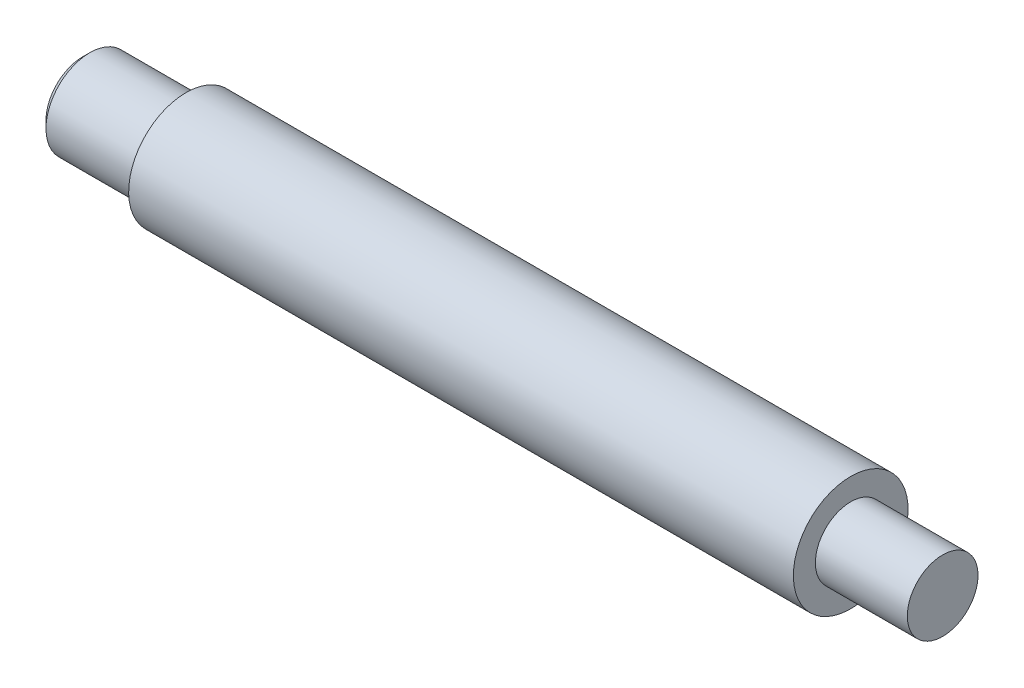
SolidWorks part; units mm, degrees
ref_plane "Front Plane" through (0, 0, 0) normal (0, 0, 1) x (1, 0, 0)
ref_plane "Top Plane" through (0, 0, 0) normal (0, 1, 0) x (1, 0, 0)
ref_plane "Right Plane" through (0, 0, 0) normal (1, 0, 0) x (0, 0, -1)
sketch "Sketch1" plane through (0, 0, 0) normal (0, 0, 1) x (1, 0, 0)
  line L0 (60.8, 0) -> (0, 0) construction
  line L1 (60.8, 0) -> (60.8, -2.5)
  line L2 (60.8, -2.5) -> (54.3, -2.5)
  line L3 (54.3, -2.5) -> (54.3, -4.055)
  line L4 (54.3, -4.055) -> (7.3, -4.055)
  line L5 (7.3, -4.055) -> (7.3, -3.1)
  line L6 (7.3, -3.1) -> (0.5, -3.1)
  line L7 (0, -2.6) -> (0, 0)
  line L8 (60.8, 0) -> (0, 0)
  line L9 (0.5, -3.1) -> (0, -2.6)
  point P9 (0, -3.1)
  dimension "D1" = 2.5
  dimension "D2" = 47
  dimension "D3" = 6.5
  dimension "D4" = 4.055
  dimension "D5" = 7.3
  dimension "D6" = 3.1
revolve "Revolve1" add sketch "Sketch1" angle 360 about L0
